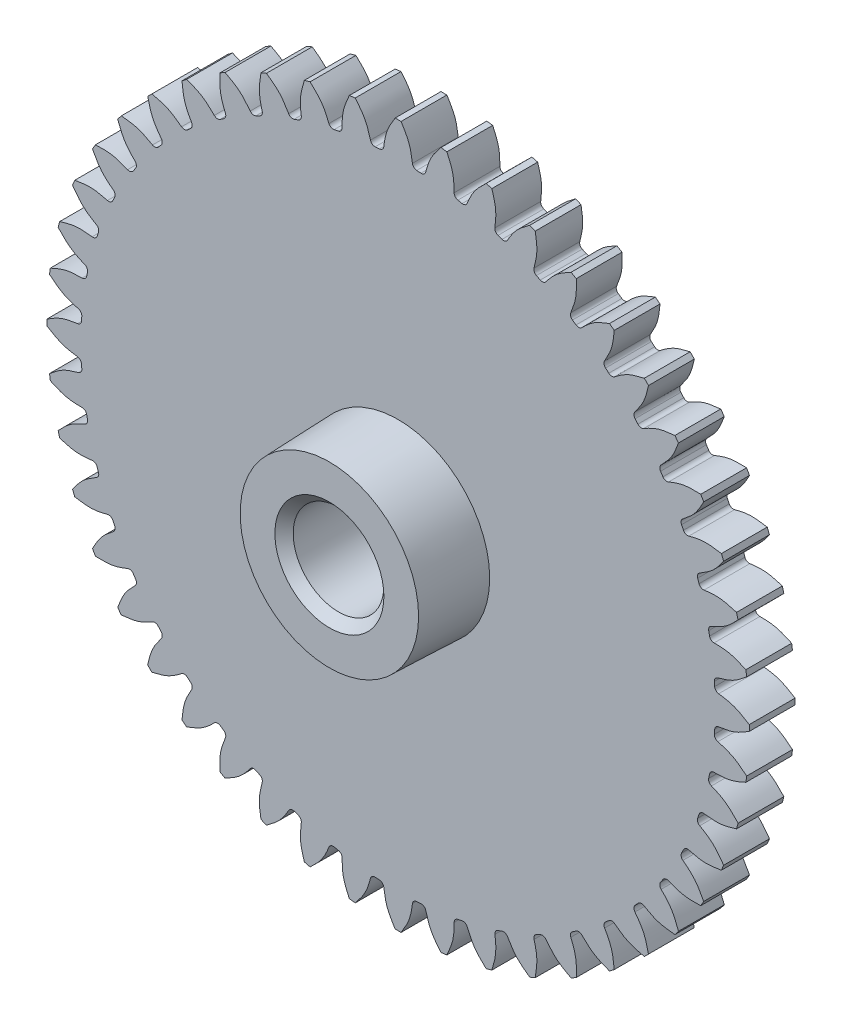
SolidWorks part; units mm, degrees
ref_plane "Face" through (0, 0, 0) normal (0, 0, 1) x (1, 0, 0)
ref_plane "Dessus" through (0, 0, 0) normal (0, 1, 0) x (1, 0, 0)
ref_plane "Droite" through (0, 0, 0) normal (1, 0, 0) x (0, 0, -1)
sketch "Esquisse1" plane through (0, 0, 0) normal (0, 0, 1) x (1, 0, 0)
  line L0 (0, 12.1501) -> (0, -6.105) construction
  line L1 (0.72, 12.0433) -> (0.72, 10.002) construction
  line L2 (0.36, 11.5985) -> (0.36, 10.9941) construction
  line L3 (-0.9735, 14.6577) -> (0.8316, 9.6984) construction
  line L4 (0, 11.5) -> (0.8727, 11.5) construction
  line L5 (0.0972, 11.5) -> (-0.0972, 11.5)
  line L6 (1.5974, 11.3889) -> (1.4047, 11.4143)
  line L7 (1.9563, 10.1988) -> (2.0955, 10.1711)
  line L8 (0.6084, 10.3669) -> (0.75, 10.3576)
  line L9 (3.0703, 11.083) -> (2.8825, 11.1333)
  line L10 (3.2708, 9.8562) -> (3.4052, 9.8106)
  line L11 (4.4907, 10.5874) -> (4.311, 10.6618)
  line L12 (4.5293, 9.3449) -> (4.6566, 9.2822)
  line L13 (5.8342, 9.9107) -> (5.6658, 10.0079)
  line L14 (5.7103, 8.6738) -> (5.8283, 8.5949)
  line L15 (7.0779, 9.0644) -> (6.9236, 9.1827)
  line L16 (6.7936, 7.8542) -> (6.9003, 7.7607)
  line L17 (8.2005, 8.063) -> (8.063, 8.2005)
  line L18 (7.7607, 6.9003) -> (7.8542, 6.7936)
  line L19 (9.1827, 6.9236) -> (9.0644, 7.0779)
  line L20 (8.5949, 5.8283) -> (8.6738, 5.7103)
  line L21 (10.0079, 5.6658) -> (9.9107, 5.8342)
  line L22 (9.2822, 4.6566) -> (9.3449, 4.5293)
  line L23 (10.6618, 4.311) -> (10.5874, 4.4907)
  line L24 (9.8106, 3.4052) -> (9.8562, 3.2708)
  line L25 (11.1333, 2.8825) -> (11.083, 3.0703)
  line L26 (10.1711, 2.0955) -> (10.1988, 1.9563)
  line L27 (11.4143, 1.4047) -> (11.3889, 1.5974)
  line L28 (10.3576, 0.75) -> (10.3669, 0.6084)
  line L29 (11.5, -0.0972) -> (11.5, 0.0972)
  line L30 (10.3669, -0.6084) -> (10.3576, -0.75)
  line L31 (11.3889, -1.5974) -> (11.4143, -1.4047)
  line L32 (10.1988, -1.9563) -> (10.1711, -2.0955)
  line L33 (11.083, -3.0703) -> (11.1333, -2.8825)
  line L34 (9.8562, -3.2708) -> (9.8106, -3.4052)
  line L35 (10.5874, -4.4907) -> (10.6618, -4.311)
  line L36 (9.3449, -4.5293) -> (9.2822, -4.6566)
  line L37 (9.9107, -5.8342) -> (10.0079, -5.6658)
  line L38 (8.6738, -5.7103) -> (8.5949, -5.8283)
  line L39 (9.0644, -7.0779) -> (9.1827, -6.9236)
  line L40 (7.8542, -6.7936) -> (7.7607, -6.9003)
  line L41 (8.063, -8.2005) -> (8.2005, -8.063)
  line L42 (6.9003, -7.7607) -> (6.7936, -7.8542)
  line L43 (6.9236, -9.1827) -> (7.0779, -9.0644)
  line L44 (5.8283, -8.5949) -> (5.7103, -8.6738)
  line L45 (5.6658, -10.0079) -> (5.8342, -9.9107)
  line L46 (4.6566, -9.2822) -> (4.5293, -9.3449)
  line L47 (4.311, -10.6618) -> (4.4907, -10.5874)
  line L48 (3.4052, -9.8106) -> (3.2708, -9.8562)
  line L49 (2.8825, -11.1333) -> (3.0703, -11.083)
  line L50 (2.0955, -10.1711) -> (1.9563, -10.1988)
  line L51 (1.4047, -11.4143) -> (1.5974, -11.3889)
  line L52 (0.75, -10.3576) -> (0.6084, -10.3669)
  line L53 (-0.0972, -11.5) -> (0.0972, -11.5)
  line L54 (-0.6084, -10.3669) -> (-0.75, -10.3576)
  line L55 (-1.5974, -11.3889) -> (-1.4047, -11.4143)
  line L56 (-1.9563, -10.1988) -> (-2.0955, -10.1711)
  line L57 (-3.0703, -11.083) -> (-2.8825, -11.1333)
  line L58 (-3.2708, -9.8562) -> (-3.4052, -9.8106)
  line L59 (-4.4907, -10.5874) -> (-4.311, -10.6618)
  line L60 (-4.5293, -9.3449) -> (-4.6566, -9.2822)
  line L61 (-5.8342, -9.9107) -> (-5.6658, -10.0079)
  line L62 (-5.7103, -8.6738) -> (-5.8283, -8.5949)
  line L63 (-7.0779, -9.0644) -> (-6.9236, -9.1827)
  line L64 (-6.7936, -7.8542) -> (-6.9003, -7.7607)
  line L65 (-8.2005, -8.063) -> (-8.063, -8.2005)
  line L66 (-7.7607, -6.9003) -> (-7.8542, -6.7936)
  line L67 (-9.1827, -6.9236) -> (-9.0644, -7.0779)
  line L68 (-8.5949, -5.8283) -> (-8.6738, -5.7103)
  line L69 (-10.0079, -5.6658) -> (-9.9107, -5.8342)
  line L70 (-9.2822, -4.6566) -> (-9.3449, -4.5293)
  line L71 (-10.6618, -4.311) -> (-10.5874, -4.4907)
  line L72 (-9.8106, -3.4052) -> (-9.8562, -3.2708)
  line L73 (-11.1333, -2.8825) -> (-11.083, -3.0703)
  line L74 (-10.1711, -2.0955) -> (-10.1988, -1.9563)
  line L75 (-11.4143, -1.4047) -> (-11.3889, -1.5974)
  line L76 (-10.3576, -0.75) -> (-10.3669, -0.6084)
  line L77 (-11.5, 0.0972) -> (-11.5, -0.0972)
  line L78 (-10.3669, 0.6084) -> (-10.3576, 0.75)
  line L79 (-11.3889, 1.5974) -> (-11.4143, 1.4047)
  line L80 (-10.1988, 1.9563) -> (-10.1711, 2.0955)
  line L81 (-11.083, 3.0703) -> (-11.1333, 2.8825)
  line L82 (-9.8562, 3.2708) -> (-9.8106, 3.4052)
  line L83 (-10.5874, 4.4907) -> (-10.6618, 4.311)
  line L84 (-9.3449, 4.5293) -> (-9.2822, 4.6566)
  line L85 (-9.9107, 5.8342) -> (-10.0079, 5.6658)
  line L86 (-8.6738, 5.7103) -> (-8.5949, 5.8283)
  line L87 (-9.0644, 7.0779) -> (-9.1827, 6.9236)
  line L88 (-7.8542, 6.7936) -> (-7.7607, 6.9003)
  line L89 (-8.063, 8.2005) -> (-8.2005, 8.063)
  line L90 (-6.9003, 7.7607) -> (-6.7936, 7.8542)
  line L91 (-6.9236, 9.1827) -> (-7.0779, 9.0644)
  line L92 (-5.8283, 8.5949) -> (-5.7103, 8.6738)
  line L93 (-5.6658, 10.0079) -> (-5.8342, 9.9107)
  line L94 (-4.6566, 9.2822) -> (-4.5293, 9.3449)
  line L95 (-4.311, 10.6618) -> (-4.4907, 10.5874)
  line L96 (-3.4052, 9.8106) -> (-3.2708, 9.8562)
  line L97 (-2.8825, 11.1333) -> (-3.0703, 11.083)
  line L98 (-2.0955, 10.1711) -> (-1.9563, 10.1988)
  line L99 (-1.4047, 11.4143) -> (-1.5974, 11.3889)
  line L100 (-0.75, 10.3576) -> (-0.6084, 10.3669)
  circle A0 centre (0, 0) radius 10.375 construction
  circle A1 centre (0, 0) radius 11 construction
  circle A2 centre (0, 0) radius 11.5 construction
  circle A3 centre (0, 0) radius 10.5 construction
  circle A4 centre (0, 0) radius 11.625 construction
  arc A5 (0.6084, 10.3669) -> (0.4694, 10.4975) centre (0.6182, 10.5166) cw
  arc A6 (0.75, 10.3576) -> (0.9048, 10.469) centre (0.7598, 10.5073) ccw
  arc A7 (-0.6084, 10.3669) -> (-0.4694, 10.4975) centre (-0.6182, 10.5166) ccw
  arc A8 (-0.75, 10.3576) -> (-0.9048, 10.469) centre (-0.7598, 10.5073) cw
  arc A9 (-1.8356, 10.3464) -> (-1.9563, 10.1988) centre (-1.9856, 10.3459) cw
  arc A10 (-2.0955, 10.1711) -> (-2.2636, 10.2613) centre (-2.1248, 10.3182) cw
  arc A11 (-3.1704, 10.0183) -> (-3.2708, 9.8562) centre (-3.319, 9.9982) cw
  arc A12 (-3.4052, 9.8106) -> (-3.5836, 9.8781) centre (-3.4534, 9.9526) cw
  arc A13 (-4.4509, 9.5188) -> (-4.5293, 9.3449) centre (-4.5956, 9.4795) cw
  arc A14 (-4.6566, 9.2822) -> (-4.8422, 9.3258) centre (-4.7229, 9.4167) cw
  arc A15 (-5.6553, 8.8564) -> (-5.7103, 8.6738) centre (-5.7936, 8.7985) cw
  arc A16 (-5.8283, 8.5949) -> (-6.0181, 8.614) centre (-5.9116, 8.7197) cw
  arc A17 (-6.7629, 8.0425) -> (-6.7936, 7.8542) centre (-6.8925, 7.967) cw
  arc A18 (-6.9003, 7.7607) -> (-7.0909, 7.7548) centre (-6.9992, 7.8734) cw
  arc A19 (-7.7548, 7.0909) -> (-7.7607, 6.9003) centre (-7.8734, 6.9992) cw
  arc A20 (-7.8542, 6.7936) -> (-8.0425, 6.7629) centre (-7.967, 6.8925) cw
  arc A21 (-8.614, 6.0181) -> (-8.5949, 5.8283) centre (-8.7197, 5.9116) cw
  arc A22 (-8.6738, 5.7103) -> (-8.8564, 5.6553) centre (-8.7985, 5.7936) cw
  arc A23 (-9.3258, 4.8422) -> (-9.2822, 4.6566) centre (-9.4167, 4.7229) cw
  arc A24 (-9.3449, 4.5293) -> (-9.5188, 4.4509) centre (-9.4795, 4.5956) cw
  arc A25 (-9.8781, 3.5836) -> (-9.8106, 3.4052) centre (-9.9526, 3.4534) cw
  arc A26 (-9.8562, 3.2708) -> (-10.0183, 3.1704) centre (-9.9982, 3.319) cw
  arc A27 (-10.2613, 2.2636) -> (-10.1711, 2.0955) centre (-10.3182, 2.1248) cw
  arc A28 (-10.1988, 1.9563) -> (-10.3464, 1.8356) centre (-10.3459, 1.9856) cw
  arc A29 (-10.469, 0.9048) -> (-10.3576, 0.75) centre (-10.5073, 0.7598) cw
  arc A30 (-10.3669, 0.6084) -> (-10.4975, 0.4694) centre (-10.5166, 0.6182) cw
  arc A31 (-10.4975, -0.4694) -> (-10.3669, -0.6084) centre (-10.5166, -0.6182) cw
  arc A32 (-10.3576, -0.75) -> (-10.469, -0.9048) centre (-10.5073, -0.7598) cw
  arc A33 (-10.3464, -1.8356) -> (-10.1988, -1.9563) centre (-10.3459, -1.9856) cw
  arc A34 (-10.1711, -2.0955) -> (-10.2613, -2.2636) centre (-10.3182, -2.1248) cw
  arc A35 (-10.0183, -3.1704) -> (-9.8562, -3.2708) centre (-9.9982, -3.319) cw
  arc A36 (-9.8106, -3.4052) -> (-9.8781, -3.5836) centre (-9.9526, -3.4534) cw
  arc A37 (-9.5188, -4.4509) -> (-9.3449, -4.5293) centre (-9.4795, -4.5956) cw
  arc A38 (-9.2822, -4.6566) -> (-9.3258, -4.8422) centre (-9.4167, -4.7229) cw
  arc A39 (-8.8564, -5.6553) -> (-8.6738, -5.7103) centre (-8.7985, -5.7936) cw
  arc A40 (-8.5949, -5.8283) -> (-8.614, -6.0181) centre (-8.7197, -5.9116) cw
  arc A41 (-8.0425, -6.7629) -> (-7.8542, -6.7936) centre (-7.967, -6.8925) cw
  arc A42 (-7.7607, -6.9003) -> (-7.7548, -7.0909) centre (-7.8734, -6.9992) cw
  arc A43 (-7.0909, -7.7548) -> (-6.9003, -7.7607) centre (-6.9992, -7.8734) cw
  arc A44 (-6.7936, -7.8542) -> (-6.7629, -8.0425) centre (-6.8925, -7.967) cw
  arc A45 (-6.0181, -8.614) -> (-5.8283, -8.5949) centre (-5.9116, -8.7197) cw
  arc A46 (-5.7103, -8.6738) -> (-5.6553, -8.8564) centre (-5.7936, -8.7985) cw
  arc A47 (-4.8422, -9.3258) -> (-4.6566, -9.2822) centre (-4.7229, -9.4167) cw
  arc A48 (-4.5293, -9.3449) -> (-4.4509, -9.5188) centre (-4.5956, -9.4795) cw
  arc A49 (-3.5836, -9.8781) -> (-3.4052, -9.8106) centre (-3.4534, -9.9526) cw
  arc A50 (-3.2708, -9.8562) -> (-3.1704, -10.0183) centre (-3.319, -9.9982) cw
  arc A51 (-2.2636, -10.2613) -> (-2.0955, -10.1711) centre (-2.1248, -10.3182) cw
  arc A52 (-1.9563, -10.1988) -> (-1.8356, -10.3464) centre (-1.9856, -10.3459) cw
  arc A53 (-0.9048, -10.469) -> (-0.75, -10.3576) centre (-0.7598, -10.5073) cw
  arc A54 (-0.6084, -10.3669) -> (-0.4694, -10.4975) centre (-0.6182, -10.5166) cw
  arc A55 (0.4694, -10.4975) -> (0.6084, -10.3669) centre (0.6182, -10.5166) cw
  arc A56 (0.75, -10.3576) -> (0.9048, -10.469) centre (0.7598, -10.5073) cw
  arc A57 (1.8356, -10.3464) -> (1.9563, -10.1988) centre (1.9856, -10.3459) cw
  arc A58 (2.0955, -10.1711) -> (2.2636, -10.2613) centre (2.1248, -10.3182) cw
  arc A59 (3.1704, -10.0183) -> (3.2708, -9.8562) centre (3.319, -9.9982) cw
  arc A60 (3.4052, -9.8106) -> (3.5836, -9.8781) centre (3.4534, -9.9526) cw
  arc A61 (4.4509, -9.5188) -> (4.5293, -9.3449) centre (4.5956, -9.4795) cw
  arc A62 (4.6566, -9.2822) -> (4.8422, -9.3258) centre (4.7229, -9.4167) cw
  arc A63 (5.6553, -8.8564) -> (5.7103, -8.6738) centre (5.7936, -8.7985) cw
  arc A64 (5.8283, -8.5949) -> (6.0181, -8.614) centre (5.9116, -8.7197) cw
  arc A65 (6.7629, -8.0425) -> (6.7936, -7.8542) centre (6.8925, -7.967) cw
  arc A66 (6.9003, -7.7607) -> (7.0909, -7.7548) centre (6.9992, -7.8734) cw
  arc A67 (7.7548, -7.0909) -> (7.7607, -6.9003) centre (7.8734, -6.9992) cw
  arc A68 (7.8542, -6.7936) -> (8.0425, -6.7629) centre (7.967, -6.8925) cw
  arc A69 (8.614, -6.0181) -> (8.5949, -5.8283) centre (8.7197, -5.9116) cw
  arc A70 (8.6738, -5.7103) -> (8.8564, -5.6553) centre (8.7985, -5.7936) cw
  arc A71 (9.3258, -4.8422) -> (9.2822, -4.6566) centre (9.4167, -4.7229) cw
  arc A72 (9.3449, -4.5293) -> (9.5188, -4.4509) centre (9.4795, -4.5956) cw
  arc A73 (9.8781, -3.5836) -> (9.8106, -3.4052) centre (9.9526, -3.4534) cw
  arc A74 (9.8562, -3.2708) -> (10.0183, -3.1704) centre (9.9982, -3.319) cw
  arc A75 (10.2613, -2.2636) -> (10.1711, -2.0955) centre (10.3182, -2.1248) cw
  arc A76 (10.1988, -1.9563) -> (10.3464, -1.8356) centre (10.3459, -1.9856) cw
  arc A77 (10.469, -0.9048) -> (10.3576, -0.75) centre (10.5073, -0.7598) cw
  arc A78 (10.3669, -0.6084) -> (10.4975, -0.4694) centre (10.5166, -0.6182) cw
  arc A79 (10.4975, 0.4694) -> (10.3669, 0.6084) centre (10.5166, 0.6182) cw
  arc A80 (10.3576, 0.75) -> (10.469, 0.9048) centre (10.5073, 0.7598) cw
  arc A81 (10.3464, 1.8356) -> (10.1988, 1.9563) centre (10.3459, 1.9856) cw
  arc A82 (10.1711, 2.0955) -> (10.2613, 2.2636) centre (10.3182, 2.1248) cw
  arc A83 (10.0183, 3.1704) -> (9.8562, 3.2708) centre (9.9982, 3.319) cw
  arc A84 (9.8106, 3.4052) -> (9.8781, 3.5836) centre (9.9526, 3.4534) cw
  arc A85 (9.5188, 4.4509) -> (9.3449, 4.5293) centre (9.4795, 4.5956) cw
  arc A86 (9.2822, 4.6566) -> (9.3258, 4.8422) centre (9.4167, 4.7229) cw
  arc A87 (8.8564, 5.6553) -> (8.6738, 5.7103) centre (8.7985, 5.7936) cw
  arc A88 (8.5949, 5.8283) -> (8.614, 6.0181) centre (8.7197, 5.9116) cw
  arc A89 (8.0425, 6.7629) -> (7.8542, 6.7936) centre (7.967, 6.8925) cw
  arc A90 (7.7607, 6.9003) -> (7.7548, 7.0909) centre (7.8734, 6.9992) cw
  arc A91 (7.0909, 7.7548) -> (6.9003, 7.7607) centre (6.9992, 7.8734) cw
  arc A92 (6.7936, 7.8542) -> (6.7629, 8.0425) centre (6.8925, 7.967) cw
  arc A93 (6.0181, 8.614) -> (5.8283, 8.5949) centre (5.9116, 8.7197) cw
  arc A94 (5.7103, 8.6738) -> (5.6553, 8.8564) centre (5.7936, 8.7985) cw
  arc A95 (4.8422, 9.3258) -> (4.6566, 9.2822) centre (4.7229, 9.4167) cw
  arc A96 (4.5293, 9.3449) -> (4.4509, 9.5188) centre (4.5956, 9.4795) cw
  arc A97 (3.5836, 9.8781) -> (3.4052, 9.8106) centre (3.4534, 9.9526) cw
  arc A98 (3.2708, 9.8562) -> (3.1704, 10.0183) centre (3.319, 9.9982) cw
  arc A99 (2.2636, 10.2613) -> (2.0955, 10.1711) centre (2.1248, 10.3182) cw
  arc A100 (1.9563, 10.1988) -> (1.8356, 10.3464) centre (1.9856, 10.3459) cw
  point P17 (0.3633, 10.9938)
  point P22 (-0.3633, 10.9938)
  point P26 (1.7951, 10.8523)
  point P28 (1.0748, 10.9472)
  point P34 (3.1963, 10.5252)
  point P36 (2.4945, 10.7132)
  point P41 (4.5428, 10.0179)
  point P43 (3.8715, 10.296)
  point P48 (5.8115, 9.3393)
  point P50 (5.1823, 9.7025)
  point P55 (6.9808, 8.5008)
  point P57 (6.4044, 8.9431)
  point P62 (8.0306, 7.5169)
  point P64 (7.5169, 8.0306)
  point P69 (8.9431, 6.4044)
  point P71 (8.5008, 6.9808)
  point P76 (9.7025, 5.1823)
  point P78 (9.3393, 5.8115)
  point P83 (10.296, 3.8715)
  point P85 (10.0179, 4.5428)
  point P90 (10.7132, 2.4945)
  point P92 (10.5252, 3.1963)
  point P97 (10.9472, 1.0748)
  point P99 (10.8523, 1.7951)
  point P104 (10.9938, -0.3633)
  point P106 (10.9938, 0.3633)
  point P111 (10.8523, -1.7951)
  point P113 (10.9472, -1.0748)
  point P118 (10.5252, -3.1963)
  point P120 (10.7132, -2.4945)
  point P125 (10.0179, -4.5428)
  point P127 (10.296, -3.8715)
  point P132 (9.3393, -5.8115)
  point P134 (9.7025, -5.1823)
  point P139 (8.5008, -6.9808)
  point P141 (8.9431, -6.4044)
  point P146 (7.5169, -8.0306)
  point P148 (8.0306, -7.5169)
  point P153 (6.4044, -8.9431)
  point P155 (6.9808, -8.5008)
  point P160 (5.1823, -9.7025)
  point P162 (5.8115, -9.3393)
  point P167 (3.8715, -10.296)
  point P169 (4.5428, -10.0179)
  point P174 (2.4945, -10.7132)
  point P176 (3.1963, -10.5252)
  point P181 (1.0748, -10.9472)
  point P183 (1.7951, -10.8523)
  point P188 (-0.3633, -10.9938)
  point P190 (0.3633, -10.9938)
  point P195 (-1.7951, -10.8523)
  point P197 (-1.0748, -10.9472)
  point P202 (-3.1963, -10.5252)
  point P204 (-2.4945, -10.7132)
  point P209 (-4.5428, -10.0179)
  point P211 (-3.8715, -10.296)
  point P216 (-5.8115, -9.3393)
  point P218 (-5.1823, -9.7025)
  point P223 (-6.9808, -8.5008)
  point P225 (-6.4044, -8.9431)
  point P230 (-8.0306, -7.5169)
  point P232 (-7.5169, -8.0306)
  point P237 (-8.9431, -6.4044)
  point P239 (-8.5008, -6.9808)
  point P244 (-9.7025, -5.1823)
  point P246 (-9.3393, -5.8115)
  point P251 (-10.296, -3.8715)
  point P253 (-10.0179, -4.5428)
  point P258 (-10.7132, -2.4945)
  point P260 (-10.5252, -3.1963)
  point P265 (-10.9472, -1.0748)
  point P267 (-10.8523, -1.7951)
  point P272 (-10.9938, 0.3633)
  point P274 (-10.9938, -0.3633)
  point P279 (-10.8523, 1.7951)
  point P281 (-10.9472, 1.0748)
  point P286 (-10.5252, 3.1963)
  point P288 (-10.7132, 2.4945)
  point P293 (-10.0179, 4.5428)
  point P295 (-10.296, 3.8715)
  point P300 (-9.3393, 5.8115)
  point P302 (-9.7025, 5.1823)
  point P307 (-8.5008, 6.9808)
  point P309 (-8.9431, 6.4044)
  point P314 (-7.5169, 8.0306)
  point P316 (-8.0306, 7.5169)
  point P321 (-6.4044, 8.9431)
  point P323 (-6.9808, 8.5008)
  point P328 (-5.1823, 9.7025)
  point P330 (-5.8115, 9.3393)
  point P335 (-3.8715, 10.296)
  point P337 (-4.5428, 10.0179)
  point P342 (-2.4945, 10.7132)
  point P344 (-3.1963, 10.5252)
  point P349 (-1.0748, 10.9472)
  point P351 (-1.7951, 10.8523)
  dimension "D1" = 20
  dimension "D2" = 0.15
  dimension "D3" = 0.15
  dimension "D4" = 0.15
  dimension "D5" = 0.15
  dimension "D6" = 0.15
  dimension "D7" = 0.15
extrude "Base-Extrusion" add sketch "Esquisse1" along normal mid plane 1.5
sketch "Esquisse2" plane through (0, 0, 0) normal (0, 0, 1) x (1, 0, 0)
  circle A0 centre (0, 0) radius 3
extrude "Boss.-Extru.1" add sketch "Esquisse2" along normal mid plane 6
sketch "Esquisse3" plane through (0, 0, 0) normal (0, 0, 1) x (1, 0, 0)
  circle A0 centre (0, 0) radius 1.485
extrude "Enlèv. mat.-Extru.1" cut sketch "Esquisse3" against normal mid plane 10
chamfer "Chanfrein1" distance 0.3 angle 45
draft "Dépouille1" type of draft neutral plane draft angle 2 faces to draft 1 parameters "D1"=2
draft "Dépouille2" type of draft neutral plane draft angle 2 faces to draft 1 parameters "D1"=2
